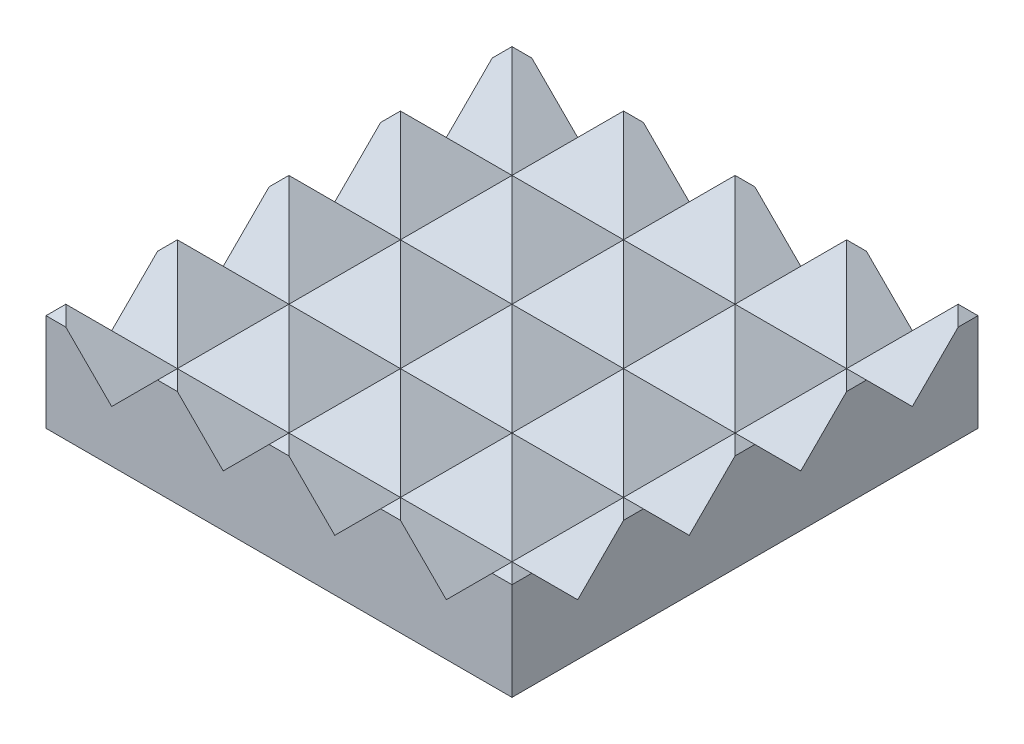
SolidWorks part; units mm, degrees
ref_plane "Front Plane" through (0, 0, 0) normal (0, 0, 1) x (1, 0, 0)
ref_plane "Top Plane" through (0, 0, 0) normal (0, 1, 0) x (1, 0, 0)
ref_plane "Right Plane" through (0, 0, 0) normal (1, 0, 0) x (0, 0, -1)
sketch "Sketch1" plane through (0, 0, 0) normal (0, 1, 0) x (1, 0, 0)
  line L0 (-6.35, -6.35) -> (-6.35, 6.35)
  line L1 (0, 0) -> (0, 50000) construction
  line L2 (0, 0) -> (50000, 0) construction
  line L3 (-6.35, 6.35) -> (6.35, 6.35)
  line L4 (6.35, -6.35) -> (6.35, 6.35)
  line L5 (-6.35, -6.35) -> (6.35, -6.35)
  point P10 (0, 6.35)
  point P11 (6.35, 0)
  point P12 (-6.35, 0)
  dimension "D1" = 12.7
  dimension "D2" = 12.7
extrude "Extrude1" add sketch "Sketch1" along normal mid plane 3.18
sketch "Sketch2" plane through (0, 0, 6.35) normal (0, 0, 1) x (1, 0, 0)
  line L0 (-7.6, 1.59) -> (-9.12, 1.59)
  line L1 (-9.12, 1.59) -> (-7.6, 0.07)
  line L2 (-6.35, -1.59) -> (6.35, -1.59) construction
  line L3 (-7.6, 0.07) -> (-6.08, 1.59)
  line L5 (-6.08, 1.59) -> (-7.6, 1.59)
  line L10 (-6.35, 1.59) -> (-6.35, -1.59) construction
  dimension "D1" = 3.04
  dimension "D2" = 2.77
  dimension "D3" = 3.18
extrude "Extrude3" cut sketch "Sketch2" against normal through all
pattern_linear "LPattern2" count 6 spacing 3.04 along (0.7071, -0.7071, 0) of "Extrude3"
sketch "Sketch3" plane through (6.35, 0, 0) normal (1, 0, 0) x (0, 0, -1)
  line L0 (-7.6, 1.59) -> (-6.08, 1.59)
  line L2 (-6.08, 1.59) -> (-7.6, 0.07)
  line L3 (-7.6, 0.07) -> (-9.12, 1.59)
  line L4 (-9.12, 1.59) -> (-7.6, 1.59)
  line L5 (-6.35, 1.32) -> (-6.35, -1.59) construction
  line L6 (7.94, 0.49) -> (-7.94, 0.49) construction
  line L8 (-6.35, -1.59) -> (6.35, -1.59) construction
  dimension "D1" = 3.04
  dimension "D2" = 2.77
  dimension "D3" = 3.18
extrude "Extrude4" cut sketch "Sketch3" against normal through all
pattern_linear "LPattern3" count 6 spacing 3.04 along (0, -0.7071, -0.7071) of "Extrude4"
chamfer "Chamfer1" distance 0.25 angle 45 4 edges at (-6.35, -1.59, 0) (0, -1.59, -6.35) (6.35, -1.59, 0) (0, -1.59, 6.35)
equation "\"D2@Sketch1\" = \"D1@Sketch1\""
equation "\"D1@Sketch3\" = \"D1@Sketch2\""
equation "\"D2@Sketch3\" = \"D2@Sketch2\""
equation "\"D3@Sketch3\" = \"D1@Extrude1\""
equation "\"D3@Sketch2\" = \"D1@Extrude1\""
